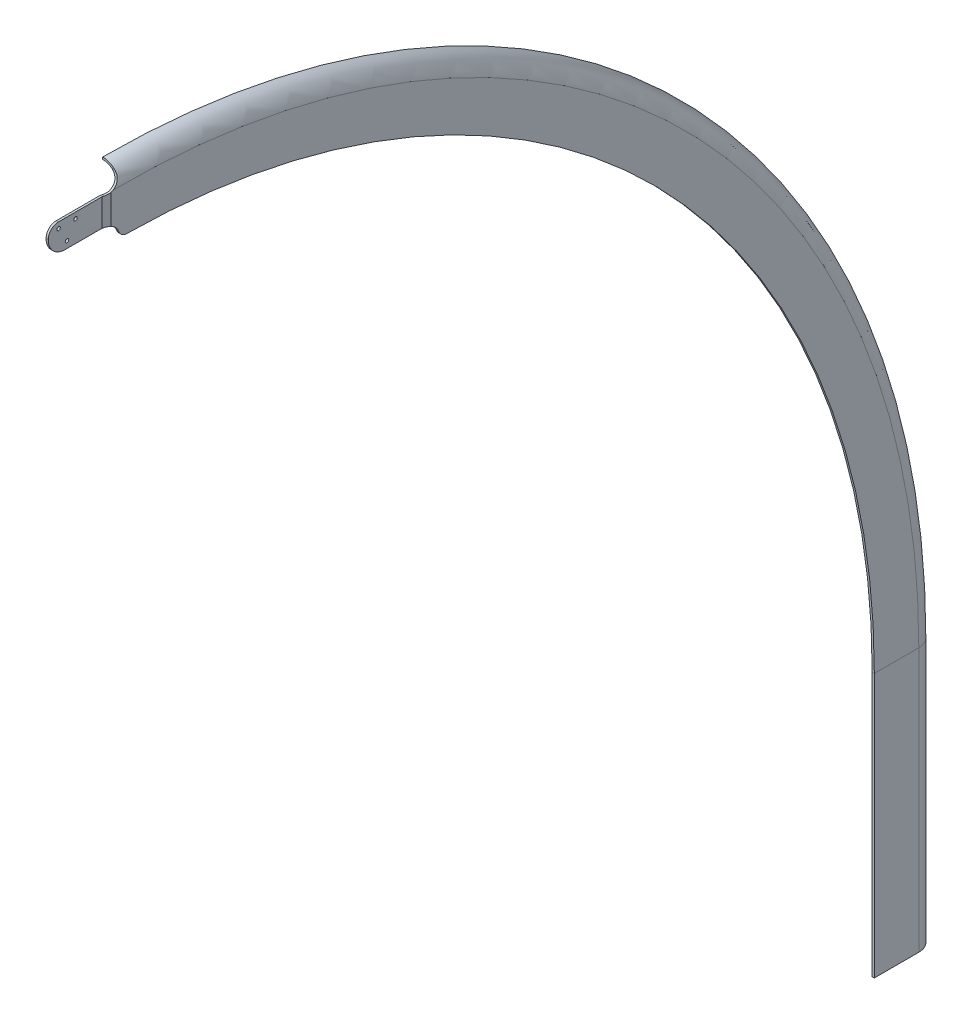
SolidWorks part; units mm, degrees
ref_plane "Front Plane" through (0, 0, 0) normal (1, 0, 0) x (0, 1, 0)
ref_plane "Top Plane" through (0, 0, 0) normal (0, 0, 1) x (0, 1, 0)
ref_plane "Right Plane" through (0, 0, 0) normal (0, 1, 0) x (-1, 0, 0)
sketch "sk 47.8in radi" plane through (0, 0, 0) normal (1, 0, 0) x (0, 1, 0)
  line B0 (-844.7111, -650.1) -> (-379.5689, -650.1)
  line B1 (-844.7111, -648.5125) -> (-379.5689, -648.5125)
  line B2 (844.7111, 574.18) -> (844.7111, 650.1)
  line B3 (843.1236, 574.18) -> (843.1236, 650.1)
  line B4 (843.1236, 650.1) -> (844.7111, 650.1)
  line B5 (-844.7111, -648.5125) -> (-844.7111, -650.1)
  arc B6 (-379.5689, -650.1) -> (844.7111, 574.18) centre (-379.5689, 574.18) ccw
  arc B7 (-379.5689, -648.5125) -> (843.1236, 574.18) centre (-379.5689, 574.18) ccw
  dimension "D1" = 650.1
  dimension "D2" = 844.7111
sketch_block_instance "Block1-1"
sketch_block "Block1" parameters "D1"=1224.28, "D2"=1222.6925, "D4"=1215.2, "D5"=1213.6125, "D3"=1.5875, "D6"=85, "D7"=474.2222
sketch "Curve Path" plane through (0, 0, 0) normal (1, 0, 0) x (0, 1, 0)
  line L0 (-844.7111, -648.5125) -> (-379.5689, -648.5125)
  line L1 (843.1236, 574.18) -> (843.1236, 650.1)
  arc A0 (843.1236, 574.18) -> (-379.5689, -648.5125) centre (-379.5689, 574.18) cw
  arc A1 (-379.5689, -648.5125) -> (843.1236, 574.18) centre (-379.5689, 574.18) ccw construction
ref_plane "Plane Body" through (0, -844.7111, 0) normal (0, 1, 0) x (-1, 0, 0)
sketch "Sketch5"
sketch_block_instance "Block3-3"
sketch_block "Block3" parameters "D1"=25.4, "D2"=16.51, "D3"=61.595, "D4"=243.65
sketch "Body" plane through (0, -844.7111, 0) normal (0, 1, 0) x (-1, 0, 0)
  line L0 (0, -648.5125) -> (92.71, -648.5125) construction
  line L1 (118.11, -623.1125) -> (118.11, -423.9125) construction
  line L2 (14.605, -398.5125) -> (92.71, -398.5125) construction
  line L3 (0, -645.3375) -> (92.71, -645.3375) construction
  line L4 (114.935, -623.1125) -> (114.935, -423.9125) construction
  line L5 (14.605, -401.6875) -> (92.71, -401.6875) construction
  line L6 (0, -645.3375) -> (0, -648.5125) construction
  line L7 (14.605, -398.5125) -> (14.605, -401.6875) construction
  line L8 (92.71, -645.3375) -> (92.71, -648.5125) construction
  line L9 (46.355, -645.3375) -> (46.355, -620.7367) construction
  line L10 (-25.4, -623.1125) -> (-25.4, -556.4375)
  line L11 (-22.225, -623.1125) -> (-22.225, -556.4375)
  line L12 (0, -645.3375) -> (0, -648.5125)
  line L13 (-22.225, -556.4375) -> (-25.4, -556.4375)
  arc A0 (118.11, -423.9125) -> (92.71, -398.5125) centre (92.71, -423.9125) ccw construction
  arc A1 (118.11, -423.9125) -> (92.71, -398.5125) centre (92.71, -423.9125) ccw construction
  arc A2 (92.71, -648.5125) -> (118.11, -623.1125) centre (92.71, -623.1125) ccw construction
  arc A3 (92.71, -648.5125) -> (118.11, -623.1125) centre (92.71, -623.1125) ccw construction
  arc A4 (92.71, -645.3375) -> (114.935, -623.1125) centre (92.71, -623.1125) ccw construction
  arc A5 (114.935, -423.9125) -> (92.71, -401.6875) centre (92.71, -423.9125) ccw construction
  arc A6 (0, -648.5125) -> (-25.4, -623.1125) centre (0, -623.1125) cw
  arc A7 (0, -645.3375) -> (-22.225, -623.1125) centre (0, -623.1125) cw
  dimension "D2" = 88.9
  dimension "D1" = 3.175
sweep "Sweep1" add profiles "Body" path "Curve Path"
sketch "Sketch6" plane through (0, 0, 0) normal (1, 0, 0) x (0, 1, 0)
  line L0 (751.0486, 574.18) -> (817.7236, 574.18) construction
  line L1 (710.7391, 660.3124) -> (870.9151, 660.3124)
  line L2 (710.7391, 660.3124) -> (710.7391, 574.18)
  line L3 (710.7391, 574.18) -> (870.9151, 574.18)
  line L4 (870.9151, 660.3124) -> (870.9151, 574.18)
extrude "Cut-Extrude1" cut sketch "Sketch6" along normal through all
ref_plane "Plane1" through (0, 751.0486, 0) normal (0, 1, 0) x (-1, 0, 0)
sketch "Sketch7" plane through (0, 751.0486, 0) normal (0, 1, 0) x (-1, 0, 0)
  line L0 (-25.4, 574.18) -> (-25.4, 587.18)
  line L1 (-25.4, 587.18) -> (-22.5536, 597.8031)
  line L2 (-22.5536, 597.8031) -> (-22.5536, 678.2483)
  line L3 (0, 574.18) -> (-25.4, 574.18) construction
  line L4 (-22.225, 574.18) -> (-22.225, 586.762)
  line L5 (-22.225, 586.762) -> (-19.3786, 597.3851)
  line L6 (-19.3786, 597.3851) -> (-19.3786, 678.2483)
  line L7 (-22.5536, 678.2483) -> (-19.3786, 678.2483)
  line L8 (-25.4, 574.18) -> (-22.225, 574.18)
  point P3 (-22.225, 595.587)
  dimension "D1" = 15
  dimension "D2" = 104.0683
  dimension "D3" = 3.175
  dimension "D4" = 80.4452
  dimension "D5" = 13
extrude "Boss-Extrude1" add sketch "Sketch7" along normal blind 63.5
sketch "Sketch8" plane through (0, 0, 0) normal (1, 0, 0) x (0, 1, 0)
  line L0 (814.5486, 574.18) -> (817.7236, 574.18) construction
  line L1 (712.401, 684.1089) -> (773.5486, 684.1089)
  line L2 (712.401, 684.1089) -> (712.401, 574.18)
  line L3 (712.401, 574.18) -> (773.5486, 574.18)
  line L4 (773.5486, 684.1089) -> (773.5486, 574.18)
  line L5 (751.0486, 678.2483) -> (751.0486, 597.8031) construction
  dimension "D1" = 22.5
extrude "Cut-Extrude2" cut sketch "Sketch8" along normal through all
sketch "Sketch9" plane through (19.3786, 0, 0) normal (-1, 0, 0) x (0, -1, 0)
  line L2 (-814.5486, 597.3851) -> (-814.5486, 678.2483) construction
  line L3 (-814.5486, 678.2483) -> (-773.5486, 678.2483) construction
  point P0 (-780.8583, 641.719)
  line B0 (-805.7236, 637.4) -> (-805.7236, 662.8) construction
  circle B1 centre (-805.7236, 662.8) radius 2.5908
  circle B2 centre (-805.7236, 637.4) radius 2.5908
  circle B3 centre (-783.7266, 650.1) radius 2.5908
  line B4 (-805.7236, 650.1) -> (-798.3913, 650.1) construction
  dimension "D1" = 8.825
  dimension "D2" = 28.1483
sketch_block_instance "Blind Rivet holes-1"
sketch_block "Blind Rivet holes" parameters "D1"=5.1816, "D2"=5.1816, "D3"=5.1816, "D4"=60, "D5"=60, "D6"=25.4, "D7"=25.4, "D8"=25.4
extrude "Tab holes 1" cut sketch "Sketch9" against normal through all
fillet "Fillet1" radius 15 1 edges at (20.9661, 814.5486, 678.2483)
fillet "Fillet2" radius 25 1 edges at (20.9661, 773.5486, 678.2483)
fillet "Fillet3" radius 21 1 edges at (23.8125, 814.5486, 574.18)
fillet "Fillet4" radius 21 1 edges at (23.8125, 773.5486, 574.18)
fillet "Fillet5" radius 13 1 edges at (23.8125, 751.0486, 574.18)
sketch "Sketch10" plane through (0, 0, 0) normal (1, 0, 0) x (0, 1, 0)
  line L0 (-844.7111, -556.4375) -> (-844.7111, -623.1125) construction
  line L1 (-859.4299, -538.7672) -> (-774.7111, -538.7672)
  line L2 (-859.4299, -538.7672) -> (-859.4299, -657.7081)
  line L3 (-859.4299, -657.7081) -> (-774.7111, -657.7081)
  line L4 (-774.7111, -538.7672) -> (-774.7111, -657.7081)
  dimension "D1" = 70
extrude "Cut-Extrude4" cut sketch "Sketch10" along normal blind 55
sketch "Sketch11" plane through (0, -774.7111, 0) normal (0, -1, 0) x (1, 0, 0)
  line L0 (0, -645.3375) -> (0, -648.5125)
  line L1 (6.25, -644.4406) -> (6.25, -647.7315)
  arc A0 (0, -645.3375) -> (6.25, -644.4406) centre (0, -623.1125) ccw
  arc A1 (0, -645.3375) -> (22.225, -623.1125) centre (0, -623.1125) ccw construction
  arc A2 (0, -648.5125) -> (6.25, -647.7315) centre (0, -623.1125) ccw
  arc A3 (0, -648.5125) -> (25.4, -623.1125) centre (0, -623.1125) ccw construction
  arc A4 (0, -645.3375) -> (22.225, -623.1125) centre (0, -623.1125) ccw construction
  point P10 (8.1982, -647.1531)
  point P15 (7.5582, -647.3619)
  dimension "D1" = 6.25
extrude "Boss-Extrude2" add sketch "Sketch11" along normal blind 13
fillet "Fillet6" radius 15 1 edges at (6.25, -774.7111, -646.0861)
fillet "Fillet7" radius 5 1 edges at (6.25, -787.7111, -646.0861)
